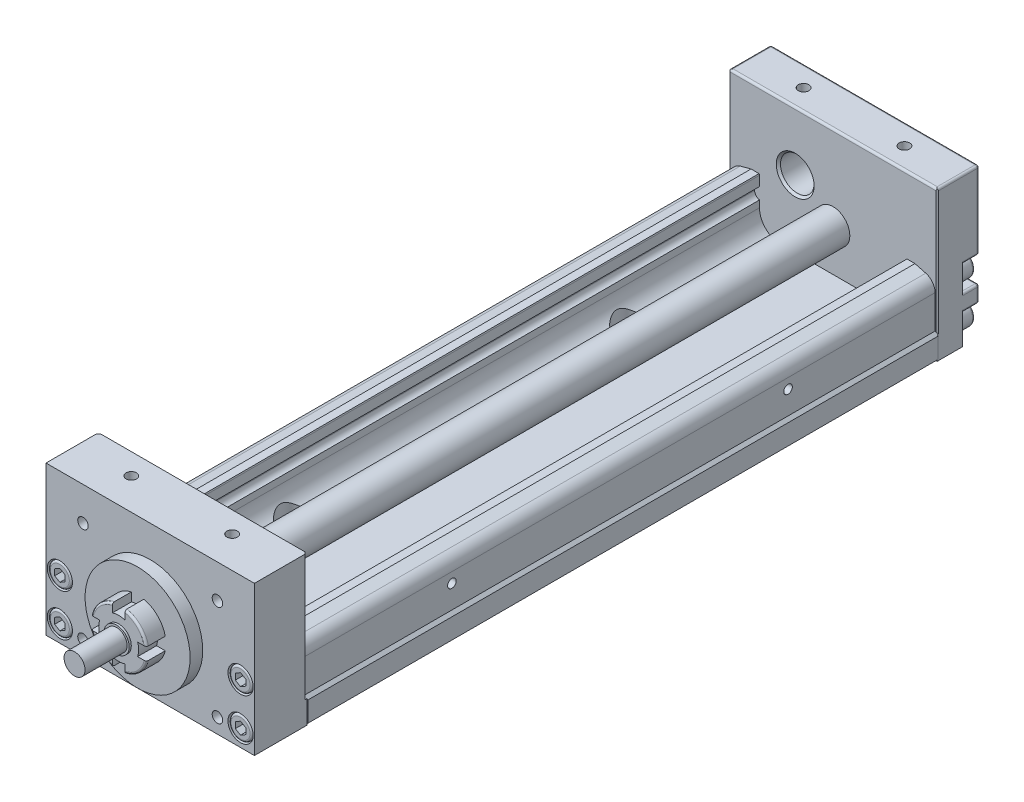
SolidWorks part; units mm, degrees
ref_plane "前视基准面" through (0, 0, 0) normal (0, 0, 1) x (1, 0, 0)
ref_plane "上视基准面" through (0, 0, 0) normal (0, 1, 0) x (1, 0, 0)
ref_plane "右视基准面" through (0, 0, 0) normal (1, 0, 0) x (0, 0, -1)
sketch "Model" plane through (0, 0, 0) normal (0, 0, 1) x (1, 0, 0)
  line L0 (26.1875, 16.7592) -> (26.6875, 16.2592)
  line L1 (23.1875, 16.7592) -> (26.1875, 16.7592)
  line L2 (22.6875, 17.2592) -> (23.1875, 16.7592)
  line L3 (22.6875, 17.2592) -> (22.6875, 22.0592)
  line L4 (23.3875, 22.7592) -> (22.6875, 22.0592)
  line L5 (23.3875, 30.671) -> (23.3875, 22.7592)
  line L6 (28.1875, 34.2592) -> (25.6111, 33.5688)
  line L7 (28.1875, 34.2592) -> (30.0875, 34.2592)
  line L8 (30.1875, 31.6398) -> (30.1875, 33.9592)
  line L9 (30.1875, 27.2592) -> (30.1875, 28.8785)
  line L10 (60.1875, 22.2592) -> (35.1875, 22.2592)
  line L11 (65.1875, 28.8785) -> (65.1875, 27.2592)
  line L12 (65.1875, 33.9592) -> (65.1875, 31.6398)
  line L13 (65.2875, 34.2592) -> (67.1875, 34.2592)
  line L14 (69.764, 33.5688) -> (67.1875, 34.2592)
  line L15 (71.9875, 22.7592) -> (71.9875, 30.671)
  line L16 (72.6875, 22.0592) -> (71.9875, 22.7592)
  line L17 (72.1875, 16.7592) -> (72.6875, 17.2592)
  line L18 (69.1875, 16.7592) -> (72.1875, 16.7592)
  line L19 (68.6875, 16.2592) -> (69.1875, 16.7592)
  line L20 (68.6875, 16.2592) -> (54.6875, 16.2592)
  line L21 (54.1875, 16.7592) -> (54.6875, 16.2592)
  line L22 (41.1875, 16.7592) -> (54.1875, 16.7592)
  line L23 (40.6875, 16.2592) -> (41.1875, 16.7592)
  line L24 (40.6875, 16.2592) -> (26.6875, 16.2592)
  line L25 (72.6875, 22.0592) -> (72.6875, 17.2592)
  arc A0 (25.6111, 33.5688) -> (23.3875, 30.671) centre (26.3875, 30.671) ccw
  arc A1 (30.1875, 33.9592) -> (30.0875, 34.2592) centre (29.6875, 33.9592) ccw
  arc A2 (30.1875, 31.6398) -> (29.0253, 30.2592) centre (30.4965, 30.2002) ccw
  arc A3 (29.0253, 30.2592) -> (30.1875, 28.8785) centre (30.4965, 30.3181) ccw
  arc A4 (30.1875, 27.2592) -> (35.1875, 22.2592) centre (35.1875, 27.2592) ccw
  arc A5 (60.1875, 22.2592) -> (65.1875, 27.2592) centre (60.1875, 27.2592) ccw
  arc A6 (65.1875, 28.8785) -> (66.3498, 30.2592) centre (64.8786, 30.3181) ccw
  arc A7 (66.3498, 30.2592) -> (65.1875, 31.6398) centre (64.8786, 30.2002) ccw
  arc A8 (65.2875, 34.2592) -> (65.1875, 33.9592) centre (65.6875, 33.9592) ccw
  arc A9 (71.9875, 30.671) -> (69.764, 33.5688) centre (68.9875, 30.671) ccw
extrude "凸台-拉伸1" add sketch "Model" along normal mid plane 150
hole_wizard "打孔尺寸(%根据)内六角圆柱头螺钉的类型1" positions "草图2" profile "草图1" counterbore size "M4" standard "GB"
sketch "草图2" plane through (0, 22.2592, 0) normal (0, 1, 0) x (1, 0, 0)
  line L0 (47.6875, -75) -> (47.6875, 75) construction
  line L1 (60.1875, -75) -> (35.1875, -75) construction
  line L2 (60.1875, 75) -> (35.1875, 75) construction
  point P0 (35.1875, -40)
  point P2 (60.1875, -40)
  dimension "D1" = 25
  dimension "D2" = 35
sketch "草图1" plane through (35.1875, 22.2592, 40) normal (1, 0, 0) x (0, 0, 1)
  line L0 (0, 0) -> (0, 6)
  line L1 (0, 6) -> (2.25, 6)
  line L3 (2.25, 6) -> (2.25, 4.6)
  line L4 (2.25, 4.6) -> (4, 4.6)
  line L5 (4, 4.6) -> (4, 0)
  line L7 (4, 0) -> (0, 0)
  line L11 (0, -6.35) -> (0, 107.95) construction
  dimension "通孔孔直径" = 4.5
  dimension "通孔孔深度" = 6
  dimension "柱形沉头孔直径" = 8
  dimension "柱形沉头孔深度" = 4.6
sketch "草图3" plane through (0, 22.2592, 0) normal (0, 1, 0) x (1, 0, 0)
  circle A0 centre (35.1875, -40) radius 4 construction
  circle A1 centre (60.1875, -40) radius 4 construction
  circle A2 centre (35.1875, -40) radius 4
  circle A3 centre (60.1875, -40) radius 4
extrude "切除-拉伸1" cut sketch "草图3" along normal blind 150
pattern_linear "阵列(线性)1" count 2 spacing 80 along (0, 0, -1) of "切除-拉伸1", "打孔尺寸(%根据)内六角圆柱头螺钉的类型1"
hole_wizard "M2.5 螺纹孔1" positions "草图5" profile "草图6" tap size "M2.5" standard "GB"
sketch "草图5" plane through (71.9875, 0, 0) normal (1, 0, 0) x (0, 0, -1)
  line L0 (-75, 22.7592) -> (-75, 30.671) construction
  line L1 (-75, 16.2592) -> (75, 16.2592) construction
  point P0 (-40, 28.2592)
  dimension "D1" = 35
  dimension "D2" = 12
sketch "草图6" plane through (71.9875, 28.2592, 40) normal (0, 1, 0) x (0, 0, -1)
  line L0 (0, 0) -> (0, 5.6159)
  line L1 (0, 5.6159) -> (1.025, 5)
  line L2 (1.025, 5) -> (1.025, 0)
  line L5 (1.025, 0) -> (0, 0)
  line L10 (0, 5.6159) -> (-1.025, 5) construction
  line L11 (0, -6.35) -> (0, 107.95) construction
  dimension "螺纹孔钻头直径" = 2.05
  dimension "螺纹孔钻头深度" = 5
  dimension "导头角度" = 118
hole_wizard "M2.5 螺纹孔2" positions "草图8" profile "草图7" tap size "M2.5" standard "GB"
sketch "草图8" plane through (23.3875, 0, 0) normal (-1, 0, 0) x (0, 0, 1)
  point P0 (40, 28.2592)
sketch "草图7" plane through (23.3875, 28.2592, 40) normal (0, 1, 0) x (0, 0, 1)
  line L0 (0, 0) -> (0, 5.6159)
  line L1 (0, 5.6159) -> (1.025, 5)
  line L2 (1.025, 5) -> (1.025, 0)
  line L5 (1.025, 0) -> (0, 0)
  line L10 (0, 5.6159) -> (-1.025, 5) construction
  line L11 (0, -6.35) -> (0, 107.95) construction
  dimension "螺纹孔钻头直径" = 2.05
  dimension "螺纹孔钻头深度" = 5
  dimension "导头角度" = 118
pattern_linear "阵列(线性)2" count 2 spacing 80 along (0, 0, -1) of "M2.5 螺纹孔2", "M2.5 螺纹孔1"
sketch "草图9" plane through (0, 0, 75) normal (0, 0, 1) x (1, 0, 0)
  line L0 (47.6875, 16.7592) -> (47.6875, 50.1591) construction
  line L1 (22.8875, 54.7592) -> (72.4875, 54.7592)
  line L2 (22.8875, 54.7592) -> (22.8875, 16.7592)
  line L3 (22.8875, 16.7592) -> (72.4875, 16.7592)
  line L4 (72.4875, 54.7592) -> (72.4875, 16.7592)
  line L5 (41.1875, 16.7592) -> (54.1875, 16.7592) construction
  line L6 (26.6875, 16.2592) -> (40.6875, 16.2592) construction
  line L7 (54.6875, 16.2592) -> (68.6875, 16.2592) construction
  circle A0 centre (47.6875, 32.2592) radius 4
  dimension "D4" = 8
  dimension "D5" = 16
  dimension "D1" = 49.6
  dimension "D2" = 0.5
  dimension "D3" = 38.5
extrude "凸台-拉伸2" add sketch "草图9" along normal blind 60
sketch "草图10" plane through (72.4875, 0, 0) normal (1, 0, 0) x (0, 0, -1)
  line L0 (-84, 16.7592) -> (-84, 37.2592)
  line L1 (-135, 16.7592) -> (-75, 16.7592) construction
  line L2 (-84, 37.2592) -> (-92, 37.2592)
  line L3 (-92, 37.2592) -> (-92, 43.2592)
  line L4 (-92, 43.2592) -> (-120, 43.2592)
  line L5 (-120, 43.2592) -> (-120, 16.7592)
  line L6 (-120, 16.7592) -> (-84, 16.7592)
  line L7 (-75, 22.2592) -> (-75, 54.7592) construction
  dimension "D1" = 9
  dimension "D2" = 8
  dimension "D3" = 36
  dimension "D4" = 20.5
  dimension "D5" = 26.5
extrude "切除-拉伸2" cut sketch "草图10" against normal blind 11
sketch "草图11" plane through (22.8875, 0, 0) normal (-1, 0, 0) x (0, 0, 1)
  line L6 (84, 16.7592) -> (120, 16.7592)
  line L7 (84, 37.2592) -> (84, 16.7592)
  line L8 (92, 37.2592) -> (84, 37.2592)
  line L9 (92, 43.2592) -> (92, 37.2592)
  line L10 (120, 43.2592) -> (92, 43.2592)
  line L11 (120, 16.7592) -> (120, 43.2592)
  line L12 (84, 16.7592) -> (120, 16.7592)
  line L13 (84, 37.2592) -> (84, 16.7592)
  line L14 (92, 37.2592) -> (84, 37.2592)
  line L15 (92, 43.2592) -> (92, 37.2592)
  line L16 (120, 43.2592) -> (92, 43.2592)
  line L17 (120, 16.7592) -> (120, 43.2592)
  dimension "D1" = 0
extrude "切除-拉伸3" cut sketch "草图11" against normal blind 11
sketch "草图12" plane through (0, 54.7592, 0) normal (0, 1, 0) x (1, 0, 0)
  line L0 (47.6875, 75) -> (47.6875, -135) construction
  line L1 (60.1875, 75) -> (35.1875, 75) construction
  line L2 (72.4875, -135) -> (22.8875, -135) construction
  line L3 (60.1875, -75) -> (35.1875, -75) construction
  line L4 (32.6875, -90.5) -> (62.6875, -90.5)
  line L5 (32.6875, -90.5) -> (32.6875, -123)
  line L6 (32.6875, -123) -> (62.6875, -123)
  line L7 (62.6875, -90.5) -> (62.6875, -123)
  dimension "D1" = 15.5
  dimension "D2" = 32.5
  dimension "D3" = 30
extrude "切除-拉伸4" cut sketch "草图12" against normal blind 33
sketch "草图13" plane through (0, 0, 135) normal (0, 0, 1) x (1, 0, 0)
  circle A0 centre (47.6875, 32.2592) radius 12
  dimension "D1" = 24
extrude "切除-拉伸5" cut sketch "草图13" against normal up to surface (44.5 mm away)
sketch "草图15" plane through (22.8875, 0, 0) normal (-1, 0, 0) x (0, 0, 1)
  line L1 (75, 54.7592) -> (90, 54.7592)
  line L2 (75, 54.7592) -> (75, 52.2592)
  line L3 (75, 52.2592) -> (90, 52.2592)
  line L4 (90, 54.7592) -> (90, 52.2592)
  dimension "D1" = 2.5
  dimension "D2" = 15
extrude "切除-拉伸6" cut sketch "草图15" against normal through all
hole_wizard "M3 螺纹孔1" positions "草图18" profile "草图17" tap size "M3" standard "GB"
sketch "草图18" plane through (0, 0, 135) normal (0, 0, 1) x (1, 0, 0)
  line L0 (47.6875, 44.2592) -> (47.6875, 32.2592) construction
  line L1 (47.6875, 32.2592) -> (35.6875, 32.2592) construction
  line L3 (36.0203, 43.9264) -> (59.3548, 20.5919) construction
  line L5 (59.3548, 43.9264) -> (36.0203, 20.5919) construction
  circle A0 centre (47.6875, 32.2592) radius 12 construction
  circle A1 centre (47.6875, 32.2592) radius 16.5
  point P0 (36.0203, 43.9264)
  point P16 (59.3548, 20.5919)
  point P18 (59.3548, 43.9264)
  point P19 (36.0203, 20.5919)
  dimension "D1" = 33
  dimension "D2" = 45
sketch "草图17" plane through (36.0203, 43.9264, 135) normal (1, 0, 0) x (0, -1, 0)
  line L0 (0, 0) -> (0, 9.2511)
  line L1 (0, 9.2511) -> (1.25, 8.5)
  line L2 (1.25, 8.5) -> (1.25, 0)
  line L5 (1.25, 0) -> (0, 0)
  line L10 (0, 9.2511) -> (-1.25, 8.5) construction
  line L11 (0, -6.35) -> (0, 107.95) construction
  dimension "螺纹孔钻头直径" = 2.5
  dimension "螺纹孔钻头深度" = 8.5
  dimension "导头角度" = 118
sketch "草图19" plane through (0, 0, 135) normal (0, 0, 1) x (1, 0, 0)
  line L0 (47.6875, 54.7592) -> (47.6875, 16.7592) construction
  line L1 (72.4875, 54.7592) -> (22.8875, 54.7592) construction
  line L2 (22.8875, 16.7592) -> (72.4875, 16.7592) construction
  circle A0 centre (26.1875, 30.7592) radius 1.75
  circle A1 centre (26.1875, 20.7592) radius 1.75
  circle A2 centre (69.1875, 30.7592) radius 1.75
  circle A3 centre (69.1875, 20.7592) radius 1.75
  dimension "D1" = 43
  dimension "D2" = 4
  dimension "D3" = 10
  dimension "D4" = 3.5
extrude "切除-拉伸7" cut sketch "草图19" against normal blind 33
fillet "圆角1" radius 2.5 8 edges at (27.7875, 43.2592, 120) (67.5875, 43.2592, 120) (66.9875, 37.2592, 84) (67.5875, 37.2592, 92) (67.5875, 43.2592, 92) (28.3875, 37.2592, 84) (27.7875, 37.2592, 92) (27.7875, 43.2592, 92)
fillet "圆角2" radius 1.5 4 edges at (32.6875, 38.2592, 123) (32.6875, 46.1135, 90.5) (62.6875, 38.2592, 123) (62.6875, 46.1135, 90.5)
fillet "圆角3" radius 0.5 28 edges at (72.4875, 25.7592, 84) (72.4875, 36.5269, 84.7322) (72.4875, 37.2592, 88) (72.4875, 37.9914, 91.2678) (72.4875, 40.2592, 92) (72.4875, 42.5269, 92.7322) (72.4875, 28.7592, 120) (72.4875, 42.5269, 119.2678) (22.8875, 25.7592, 84) (22.8875, 42.5269, 119.2678) (22.8875, 43.2592, 106) (22.8875, 42.5269, 92.7322) (22.8875, 40.2592, 92) (22.8875, 37.9914, 91.2678) (22.8875, 37.2592, 88) (62.2482, 54.7592, 90.9393) (62.6875, 54.7592, 106.75) (62.2482, 54.7592, 122.5607) (33.1269, 54.7592, 122.5607) (32.6875, 54.7592, 106.75) (33.1269, 54.7592, 90.9393) (72.4875, 43.2592, 106) (22.8875, 36.5269, 84.7322) (47.6875, 54.7592, 90.5) (72.4875, 54.7592, 112.5) (22.8875, 54.7592, 112.5) (22.8875, 28.7592, 120) (47.6875, 54.7592, 123)
chamfer "倒角1" distance 0.5 angle 45 17 edges at (47.6875, 16.7592, 135) (22.8875, 35.5092, 135) (23.034, 54.6127, 135) (47.6875, 54.7592, 135) (72.3411, 54.6127, 135) (72.4875, 35.5092, 135) (59.6875, 32.2592, 135) (37.2703, 20.5919, 135) (60.6048, 43.9264, 135) (60.6048, 20.5919, 135) (37.2703, 43.9264, 135) (27.9375, 30.7592, 135) (27.9375, 20.7592, 135) (70.9375, 30.7592, 135) (70.9375, 20.7592, 135) (22.8875, 37.2592, 75) (72.4875, 37.2592, 75)
sketch "草图20" plane through (0, 0, 90.5) normal (0, 0, 1) x (1, 0, 0)
  circle A0 centre (47.6875, 32.2592) radius 4 construction
  circle A1 centre (47.6875, 32.2592) radius 4
extrude "凸台-拉伸3" add sketch "草图20" against normal up to surface (165.5 mm away)
sketch "草图21" plane through (0, 0, 90.5) normal (0, 0, 1) x (1, 0, 0)
  line L0 (47.6875, 39.0092) -> (47.6875, 25.5092) construction
  line L1 (42.9375, 32.2592) -> (52.4375, 32.2592) construction
  line L2 (46.1875, 38.8404) -> (46.1875, 36.7661)
  line L3 (41.1063, 30.7592) -> (43.1806, 30.7592)
  line L4 (49.1875, 38.8404) -> (49.1875, 36.7661)
  line L5 (41.1063, 33.7592) -> (43.1806, 33.7592)
  line L6 (46.1875, 33.7592) -> (46.1875, 30.7592) construction
  line L7 (46.1875, 39.0092) -> (46.1875, 25.5092) construction
  line L8 (49.1875, 39.0092) -> (49.1875, 25.5092) construction
  line L9 (49.1875, 33.7592) -> (49.1875, 30.7592) construction
  line L10 (42.9375, 33.7592) -> (52.4375, 33.7592) construction
  line L11 (42.9375, 30.7592) -> (52.4375, 30.7592) construction
  line L12 (52.1945, 30.7592) -> (54.2688, 30.7592)
  line L13 (52.1945, 33.7592) -> (54.2688, 33.7592)
  line L14 (46.1875, 33.7592) -> (49.1875, 33.7592) construction
  line L15 (46.1875, 30.7592) -> (49.1875, 30.7592) construction
  line L16 (46.1875, 27.7522) -> (46.1875, 25.6779)
  line L17 (49.1875, 27.7522) -> (49.1875, 25.6779)
  arc A0 (46.1875, 38.8404) -> (41.1063, 33.7592) centre (47.6875, 32.2592) ccw
  arc A1 (49.1875, 36.7661) -> (46.1875, 36.7661) centre (47.6875, 32.2592) ccw
  arc A2 (43.1806, 33.7592) -> (43.1806, 30.7592) centre (47.6875, 32.2592) ccw
  arc A3 (41.1063, 30.7592) -> (46.1875, 25.6779) centre (47.6875, 32.2592) ccw
  arc A4 (49.1875, 25.6779) -> (54.2688, 30.7592) centre (47.6875, 32.2592) ccw
  arc A5 (54.2688, 33.7592) -> (49.1875, 38.8404) centre (47.6875, 32.2592) ccw
  arc A6 (46.1875, 27.7522) -> (49.1875, 27.7522) centre (47.6875, 32.2592) ccw
  arc A7 (52.1945, 30.7592) -> (52.1945, 33.7592) centre (47.6875, 32.2592) ccw
  dimension "D1" = 13.5
  dimension "D3" = 9.5
  dimension "D4" = 1.5
  dimension "D5" = 1.5
extrude "凸台-拉伸4" add sketch "草图21" along normal blind 4.5
sketch "草图22" plane through (0, 0, 95) normal (0, 0, 1) x (1, 0, 0)
  circle A0 centre (47.6875, 32.2592) radius 3
  dimension "D1" = 6
extrude "凸台-拉伸5" add sketch "草图22" along normal blind 0.5
sketch "草图23" plane through (0, 0, 95.5) normal (0, 0, 1) x (1, 0, 0)
  circle A0 centre (47.6875, 32.2592) radius 2.5
  dimension "D1" = 5
extrude "凸台-拉伸6" add sketch "草图23" along normal blind 10
fillet "圆角4" radius 0.5 4 edges at (52.4605, 27.4862, 95) (42.9146, 27.4862, 95) (42.9146, 37.0321, 95) (52.4605, 37.0321, 95)
sketch "草图24" plane through (0, 0, 84) normal (0, 0, 1) x (1, 0, 0)
  circle A0 centre (26.1875, 30.7592) radius 2.75
  circle A1 centre (26.1875, 20.7592) radius 2.75
  circle A2 centre (69.1875, 30.7592) radius 2.75
  circle A3 centre (69.1875, 20.7592) radius 2.75
  dimension "D1" = 5.5
extrude "凸台-拉伸7" add sketch "草图24" along normal blind 3.5
sketch "草图25" plane through (0, 0, 87.5) normal (0, 0, 1) x (1, 0, 0)
  line L1 (26.1875, 32.2025) -> (24.9375, 31.4808)
  line L2 (24.9375, 31.4808) -> (24.9375, 30.0375)
  line L3 (24.9375, 30.0375) -> (26.1875, 29.3158)
  line L4 (26.1875, 29.3158) -> (27.4375, 30.0375)
  line L5 (27.4375, 30.0375) -> (27.4375, 31.4808)
  line L6 (27.4375, 31.4808) -> (26.1875, 32.2025)
  line L7 (26.1875, 22.2025) -> (24.9375, 21.4808)
  line L8 (24.9375, 21.4808) -> (24.9375, 20.0375)
  line L9 (24.9375, 20.0375) -> (26.1875, 19.3158)
  line L10 (26.1875, 19.3158) -> (27.4375, 20.0375)
  line L11 (27.4375, 20.0375) -> (27.4375, 21.4808)
  line L12 (27.4375, 21.4808) -> (26.1875, 22.2025)
  line L13 (69.1875, 22.2025) -> (67.9375, 21.4808)
  line L14 (67.9375, 21.4808) -> (67.9375, 20.0375)
  line L15 (67.9375, 20.0375) -> (69.1875, 19.3158)
  line L16 (69.1875, 19.3158) -> (70.4375, 20.0375)
  line L17 (70.4375, 20.0375) -> (70.4375, 21.4808)
  line L18 (70.4375, 21.4808) -> (69.1875, 22.2025)
  line L19 (69.1875, 32.2025) -> (67.9375, 31.4808)
  line L20 (67.9375, 31.4808) -> (67.9375, 30.0375)
  line L21 (67.9375, 30.0375) -> (69.1875, 29.3158)
  line L22 (69.1875, 29.3158) -> (70.4375, 30.0375)
  line L23 (70.4375, 30.0375) -> (70.4375, 31.4808)
  line L24 (70.4375, 31.4808) -> (69.1875, 32.2025)
  circle A0 centre (26.1875, 30.7592) radius 1.25 construction
  circle A1 centre (26.1875, 20.7592) radius 1.25 construction
  circle A2 centre (69.1875, 20.7592) radius 1.25 construction
  circle A3 centre (69.1875, 30.7592) radius 1.25 construction
  dimension "D1" = 2.5
extrude "切除-拉伸8" cut sketch "草图25" against normal blind 2.5
fillet "圆角5" radius 0.5 4 edges at (71.9375, 30.7592, 87.5) (71.9375, 20.7592, 87.5) (28.9375, 20.7592, 87.5) (28.9375, 30.7592, 87.5)
sketch "草图26" plane through (0, 0, 75) normal (0, 0, -1) x (-1, 0, 0)
  line L0 (-61.1875, 32.2592) -> (-34.1875, 32.2592) construction
  line L13 (-57.7499, 23.2592) -> (-37.6252, 23.2592)
  line L14 (-57.7499, 41.2592) -> (-37.6252, 41.2592)
  line L16 (-61.1875, 41.2592) -> (-34.1875, 41.2592) construction
  line L17 (-61.1875, 23.2592) -> (-34.1875, 23.2592) construction
  arc A0 (-57.7499, 41.2592) -> (-57.7499, 23.2592) centre (-47.6875, 32.2592) ccw
  arc A11 (-37.6252, 23.2592) -> (-37.6252, 41.2592) centre (-47.6875, 32.2592) ccw
  circle A12 centre (-47.6875, 32.2592) radius 6
  dimension "D1" = 27
  dimension "D4" = 12
  dimension "D2" = 9
  dimension "D3" = 9
extrude "凸台-拉伸8" add sketch "草图26" along normal blind 2.5
chamfer "倒角2" distance 0.5 angle 45 5 edges at (41.6875, 32.2592, 72.5) (47.6875, 23.2592, 72.5) (61.1875, 32.2592, 72.5) (47.6875, 41.2592, 72.5) (34.1875, 32.2592, 72.5)
sketch "草图27" plane through (0, 0, 72.5) normal (0, 0, -1) x (-1, 0, 0)
  line L0 (-47.6875, 43.2592) -> (-47.6875, 32.2592) construction
  line L1 (-47.6875, 32.2592) -> (-58.6875, 32.2592) construction
  line L2 (-57.2138, 37.7592) -> (-38.1613, 26.7592) construction
  line L3 (-38.1613, 37.7592) -> (-57.2138, 26.7592) construction
  circle A0 centre (-47.6875, 32.2592) radius 11 construction
  circle A1 centre (-57.2138, 37.7592) radius 2.75
  circle A2 centre (-57.2138, 26.7592) radius 2.75
  circle A3 centre (-38.1613, 37.7592) radius 2.75
  circle A4 centre (-38.1613, 26.7592) radius 2.75
  dimension "D1" = 22
  dimension "D4" = 5.5
  dimension "D2" = 30
  dimension "D3" = 30
extrude "凸台-拉伸9" add sketch "草图27" along normal blind 3.5
sketch "草图28" plane through (0, 0, 69) normal (0, 0, -1) x (-1, 0, 0)
  line L1 (-57.9355, 39.0092) -> (-58.6572, 37.7592)
  line L2 (-58.6572, 37.7592) -> (-57.9355, 36.5092)
  line L3 (-57.9355, 36.5092) -> (-56.4921, 36.5092)
  line L4 (-56.4921, 36.5092) -> (-55.7704, 37.7592)
  line L5 (-55.7704, 37.7592) -> (-56.4921, 39.0092)
  line L6 (-56.4921, 39.0092) -> (-57.9355, 39.0092)
  line L7 (-38.883, 39.0092) -> (-39.6046, 37.7592)
  line L8 (-39.6046, 37.7592) -> (-38.883, 36.5092)
  line L9 (-38.883, 36.5092) -> (-37.4396, 36.5092)
  line L10 (-37.4396, 36.5092) -> (-36.7179, 37.7592)
  line L11 (-36.7179, 37.7592) -> (-37.4396, 39.0092)
  line L12 (-37.4396, 39.0092) -> (-38.883, 39.0092)
  line L13 (-38.883, 28.0092) -> (-39.6046, 26.7592)
  line L14 (-39.6046, 26.7592) -> (-38.883, 25.5092)
  line L15 (-38.883, 25.5092) -> (-37.4396, 25.5092)
  line L16 (-37.4396, 25.5092) -> (-36.7179, 26.7592)
  line L17 (-36.7179, 26.7592) -> (-37.4396, 28.0092)
  line L18 (-37.4396, 28.0092) -> (-38.883, 28.0092)
  line L19 (-57.9355, 28.0092) -> (-58.6572, 26.7592)
  line L20 (-58.6572, 26.7592) -> (-57.9355, 25.5092)
  line L21 (-57.9355, 25.5092) -> (-56.4921, 25.5092)
  line L22 (-56.4921, 25.5092) -> (-55.7704, 26.7592)
  line L23 (-55.7704, 26.7592) -> (-56.4921, 28.0092)
  line L24 (-56.4921, 28.0092) -> (-57.9355, 28.0092)
  circle A0 centre (-57.2138, 37.7592) radius 1.25 construction
  circle A1 centre (-38.1613, 37.7592) radius 1.25 construction
  circle A2 centre (-38.1613, 26.7592) radius 1.25 construction
  circle A3 centre (-57.2138, 26.7592) radius 1.25 construction
  dimension "D1" = 2.5
extrude "切除-拉伸9" cut sketch "草图28" against normal blind 2.5
fillet "圆角6" radius 0.5 4 edges at (35.4113, 26.7592, 69) (54.4638, 26.7592, 69) (54.4638, 37.7592, 69) (35.4113, 37.7592, 69)
sketch "草图29" plane through (0, 0, -75) normal (0, 0, -1) x (-1, 0, 0)
  line L0 (-69.1875, 16.7592) -> (-72.1875, 16.7592) construction
  line L1 (-72.4875, 52.2592) -> (-22.8875, 52.2592)
  line L2 (-72.4875, 52.2592) -> (-72.4875, 16.7592)
  line L3 (-72.4875, 16.7592) -> (-22.8875, 16.7592)
  line L4 (-22.8875, 52.2592) -> (-22.8875, 16.7592)
  line L5 (-22.8875, 52.2592) -> (-22.8875, 22.2592) construction
  line L6 (-72.4875, 22.2592) -> (-72.4875, 52.2592) construction
  line L8 (-72.4875, 52.2592) -> (-22.8875, 52.2592) construction
extrude "凸台-拉伸10" add sketch "草图29" along normal blind 10
sketch "草图30" plane through (0, 0, -85) normal (0, 0, -1) x (-1, 0, 0)
  circle A0 centre (-47.6875, 32.2592) radius 5.5
  dimension "D1" = 11
extrude "切除-拉伸10" cut sketch "草图30" against normal blind 2.5
sketch "草图31" plane through (0, 0, -82.5) normal (0, 0, -1) x (-1, 0, 0)
  circle A0 centre (-47.6875, 32.2592) radius 2.5
  dimension "D1" = 5
extrude "凸台-拉伸11" add sketch "草图31" along normal blind 2 separate body
sketch "草图32" plane through (0, 0, -82.5) normal (0, 0, -1) x (-1, 0, 0)
  circle A0 centre (-47.6875, 32.2592) radius 3
  circle A1 centre (-47.6875, 32.2592) radius 4.5
  dimension "D1" = 9
  dimension "D2" = 6
extrude "切除-拉伸11" cut sketch "草图32" against normal blind 0.3
chamfer "倒角3" distance 0.3 angle 45 1 edges at (45.1875, 32.2592, -84.5)
chamfer "倒角4" distance 0.3 angle 45 3 edges at (42.1875, 32.2592, -85) (22.8875, 37.2592, -75) (72.4875, 37.2592, -75)
fillet "圆角7" radius 0.3 2 edges at (43.1875, 32.2592, -82.5) (44.6875, 32.2592, -82.5)
fillet "圆角8" radius 0.5 7 edges at (47.6875, 16.7592, -85) (22.8875, 34.5092, -85) (72.4875, 34.5092, -85) (47.6875, 52.2592, -85) (47.6875, 52.2592, -75) (22.8875, 52.2592, -80.15) (72.4875, 52.2592, -80.15)
sketch "草图34" plane through (0, 0, -85) normal (0, 0, -1) x (-1, 0, 0)
  line L0 (-69.1875, 33.7592) -> (-72.4875, 33.7592)
  line L1 (-72.4875, 16.7592) -> (-72.4875, 51.7592) construction
  line L2 (-72.4875, 33.7592) -> (-72.4875, 27.7592)
  line L3 (-72.4875, 27.7592) -> (-69.1875, 27.7592)
  line L4 (-69.1875, 23.7592) -> (-72.4875, 23.7592)
  line L5 (-72.4875, 23.7592) -> (-72.4875, 16.7592)
  line L6 (-72.4875, 16.7592) -> (-66.1875, 16.7592)
  line L7 (-69.1875, 16.7592) -> (-54.1875, 16.7592) construction
  line L8 (-66.1875, 16.7592) -> (-66.1875, 20.7592)
  line L9 (-26.1875, 33.7592) -> (-22.8875, 33.7592)
  line L10 (-22.8875, 51.7592) -> (-22.8875, 16.7592) construction
  line L11 (-22.8875, 33.7592) -> (-22.8875, 27.7592)
  line L12 (-22.8875, 27.7592) -> (-26.1875, 27.7592)
  line L13 (-26.1875, 23.7592) -> (-22.8875, 23.7592)
  line L14 (-22.8875, 23.7592) -> (-22.8875, 16.7592)
  line L15 (-22.8875, 16.7592) -> (-29.1875, 16.7592)
  line L16 (-22.8875, 16.7592) -> (-72.4875, 16.7592) construction
  line L17 (-29.1875, 16.7592) -> (-29.1875, 20.7592)
  arc A0 (-69.1875, 27.7592) -> (-69.1875, 33.7592) centre (-69.1875, 30.7592) ccw
  arc A1 (-66.1875, 20.7592) -> (-69.1875, 23.7592) centre (-69.1875, 20.7592) ccw
  arc A2 (-26.1875, 33.7592) -> (-26.1875, 27.7592) centre (-26.1875, 30.7592) ccw
  arc A3 (-26.1875, 23.7592) -> (-29.1875, 20.7592) centre (-26.1875, 20.7592) ccw
  dimension "D1" = 6
extrude "切除-拉伸12" cut sketch "草图34" against normal blind 4
sketch "草图35" plane through (0, 0, -81) normal (0, 0, -1) x (-1, 0, 0)
  circle A0 centre (-69.1875, 30.7592) radius 2.75 construction
  circle A1 centre (-69.1875, 20.7592) radius 2.75 construction
  circle A2 centre (-26.1875, 30.7592) radius 2.75 construction
  circle A3 centre (-26.1875, 20.7592) radius 2.75 construction
  circle A4 centre (-69.1875, 30.7592) radius 2.75
  circle A5 centre (-69.1875, 20.7592) radius 2.75
  circle A6 centre (-26.1875, 30.7592) radius 2.75
  circle A7 centre (-26.1875, 20.7592) radius 2.75
extrude "凸台-拉伸12" add sketch "草图35" along normal blind 3.5
sketch "草图36" plane through (0, 0, -84.5) normal (0, 0, -1) x (-1, 0, 0)
  line L0 (-70.4375, 31.4808) -> (-69.1875, 32.2025) construction
  line L1 (-69.1875, 32.2025) -> (-67.9375, 31.4808) construction
  line L2 (-67.9375, 31.4808) -> (-67.9375, 30.0375) construction
  line L3 (-67.9375, 30.0375) -> (-69.1875, 29.3158) construction
  line L4 (-69.1875, 29.3158) -> (-70.4375, 30.0375) construction
  line L5 (-70.4375, 30.0375) -> (-70.4375, 31.4808) construction
  line L6 (-70.4375, 21.4808) -> (-69.1875, 22.2025) construction
  line L7 (-69.1875, 22.2025) -> (-67.9375, 21.4808) construction
  line L8 (-67.9375, 21.4808) -> (-67.9375, 20.0375) construction
  line L9 (-67.9375, 20.0375) -> (-69.1875, 19.3158) construction
  line L10 (-69.1875, 19.3158) -> (-70.4375, 20.0375) construction
  line L11 (-70.4375, 20.0375) -> (-70.4375, 21.4808) construction
  line L12 (-27.4375, 21.4808) -> (-26.1875, 22.2025) construction
  line L13 (-26.1875, 22.2025) -> (-24.9375, 21.4808) construction
  line L14 (-24.9375, 21.4808) -> (-24.9375, 20.0375) construction
  line L15 (-24.9375, 20.0375) -> (-26.1875, 19.3158) construction
  line L16 (-26.1875, 19.3158) -> (-27.4375, 20.0375) construction
  line L17 (-27.4375, 20.0375) -> (-27.4375, 21.4808) construction
  line L18 (-27.4375, 31.4808) -> (-26.1875, 32.2025) construction
  line L19 (-26.1875, 32.2025) -> (-24.9375, 31.4808) construction
  line L20 (-24.9375, 31.4808) -> (-24.9375, 30.0375) construction
  line L21 (-24.9375, 30.0375) -> (-26.1875, 29.3158) construction
  line L22 (-26.1875, 29.3158) -> (-27.4375, 30.0375) construction
  line L23 (-27.4375, 30.0375) -> (-27.4375, 31.4808) construction
  line L24 (-70.4375, 31.4808) -> (-69.1875, 32.2025)
  line L25 (-69.1875, 32.2025) -> (-67.9375, 31.4808)
  line L26 (-67.9375, 31.4808) -> (-67.9375, 30.0375)
  line L27 (-67.9375, 30.0375) -> (-69.1875, 29.3158)
  line L28 (-69.1875, 29.3158) -> (-70.4375, 30.0375)
  line L29 (-70.4375, 30.0375) -> (-70.4375, 31.4808)
  line L30 (-70.4375, 21.4808) -> (-69.1875, 22.2025)
  line L31 (-69.1875, 22.2025) -> (-67.9375, 21.4808)
  line L32 (-67.9375, 21.4808) -> (-67.9375, 20.0375)
  line L33 (-67.9375, 20.0375) -> (-69.1875, 19.3158)
  line L34 (-69.1875, 19.3158) -> (-70.4375, 20.0375)
  line L35 (-70.4375, 20.0375) -> (-70.4375, 21.4808)
  line L36 (-27.4375, 21.4808) -> (-26.1875, 22.2025)
  line L37 (-26.1875, 22.2025) -> (-24.9375, 21.4808)
  line L38 (-24.9375, 21.4808) -> (-24.9375, 20.0375)
  line L39 (-24.9375, 20.0375) -> (-26.1875, 19.3158)
  line L40 (-26.1875, 19.3158) -> (-27.4375, 20.0375)
  line L41 (-27.4375, 20.0375) -> (-27.4375, 21.4808)
  line L42 (-27.4375, 31.4808) -> (-26.1875, 32.2025)
  line L43 (-26.1875, 32.2025) -> (-24.9375, 31.4808)
  line L44 (-24.9375, 31.4808) -> (-24.9375, 30.0375)
  line L45 (-24.9375, 30.0375) -> (-26.1875, 29.3158)
  line L46 (-26.1875, 29.3158) -> (-27.4375, 30.0375)
  line L47 (-27.4375, 30.0375) -> (-27.4375, 31.4808)
extrude "切除-拉伸13" cut sketch "草图36" against normal blind 2.5
fillet "圆角9" radius 0.5 32 edges at (66.1875, 16.7592, -82.75) (66.1875, 16.9056, -84.8536) (66.1875, 19.0092, -85) (72.4875, 23.7592, -82.75) (72.3411, 23.7592, -84.8536) (70.5875, 23.7592, -85) (22.8875, 23.7592, -82.75) (23.034, 23.7592, -84.8536) (24.7875, 23.7592, -85) (29.1875, 16.7592, -82.75) (29.1875, 16.9056, -84.8536) (29.1875, 19.0092, -85) (22.8875, 33.7592, -82.75) (23.034, 33.7592, -84.8536) (22.8875, 27.7592, -82.75) (23.034, 27.7592, -84.8536) (24.7875, 27.7592, -85) (29.1875, 30.7592, -85) (72.4875, 27.7592, -82.75) (72.3411, 27.7592, -84.8536) (70.5875, 27.7592, -85) (66.1875, 30.7592, -85) (72.4875, 33.7592, -82.75) (72.3411, 33.7592, -84.8536) (67.0662, 22.8805, -85) (23.4375, 20.7592, -84.5) (28.3089, 22.8805, -85) (24.7875, 33.7592, -85) (23.4375, 30.7592, -84.5) (70.5875, 33.7592, -85) (66.4375, 30.7592, -84.5) (66.4375, 20.7592, -84.5)
hole_wizard "M3 螺纹孔2" positions "草图40" profile "草图39" tap size "M3" standard "GB"
sketch "草图40" plane through (0, 52.2592, 0) normal (0, 1, 0) x (1, 0, 0)
  line L0 (47.6875, 85) -> (47.6875, -134.5) construction
  line L1 (23.3875, 85) -> (71.9875, 85) construction
  line L2 (23.3875, -134.5) -> (71.9875, -134.5) construction
  line L4 (71.9875, -75) -> (23.3875, -75) construction
  point P0 (59.6875, 80)
  point P2 (35.6875, 80)
  point P4 (59.6875, -80)
  point P6 (35.6875, -80)
  dimension "D1" = 5
  dimension "D2" = 24
  dimension "D3" = 5
sketch "草图39" plane through (59.6875, 52.2592, -80) normal (1, 0, 0) x (0, 0, 1)
  line L0 (0, 0) -> (0, 9.2511)
  line L1 (0, 9.2511) -> (1.25, 8.5)
  line L2 (1.25, 8.5) -> (1.25, 0)
  line L5 (1.25, 0) -> (0, 0)
  line L10 (0, 9.2511) -> (-1.25, 8.5) construction
  line L11 (0, -6.35) -> (0, 107.95) construction
  dimension "螺纹孔钻头直径" = 2.5
  dimension "螺纹孔钻头深度" = 8.5
  dimension "导头角度" = 118
sketch "草图41" plane through (0, 16.7592, 0) normal (0, -1, 0) x (1, 0, 0)
  line L0 (23.3875, 135) -> (71.9875, 135) construction
  line L1 (38.6875, 115) -> (56.6875, 115)
  line L2 (36.6875, 113) -> (36.6875, 101)
  line L3 (38.6875, 99) -> (56.6875, 99)
  line L4 (58.6875, 113) -> (58.6875, 101)
  line L5 (47.6875, 135) -> (47.6875, 91.4107) construction
  arc A0 (36.6875, 101) -> (38.6875, 99) centre (38.6875, 101) ccw
  arc A1 (56.6875, 99) -> (58.6875, 101) centre (56.6875, 101) ccw
  arc A2 (58.6875, 113) -> (56.6875, 115) centre (56.6875, 113) ccw
  arc A3 (36.6875, 113) -> (38.6875, 115) centre (38.6875, 113) cw
  point P12 (58.6875, 99)
  point P15 (58.6875, 115)
  point P18 (36.6875, 115)
  dimension "D4" = 2
  dimension "D1" = 20
  dimension "D2" = 16
  dimension "D3" = 22
extrude "切除-拉伸14" cut sketch "草图41" against normal blind 0.2
sketch "草图42" plane through (0, 16.9592, 0) normal (0, -1, 0) x (1, 0, 0)
  line L0 (36.6875, 113) -> (36.6875, 101) construction
  line L1 (38.6875, 99) -> (56.6875, 99) construction
  text T0 "KKR50" font "仿宋" height 5
  dimension "D1" = 2
  dimension "D2" = 5.5
extrude "凸台-拉伸13" add sketch "草图42" along normal blind 0.2
sketch "草图43" plane through (0, 0, -75) normal (0, 0, 1) x (1, 0, 0)
  circle A0 centre (38.6875, 38.2592) radius 4
  circle A1 centre (47.6875, 32.2592) radius 4 construction
  dimension "D1" = 9
  dimension "D2" = 6
  dimension "D3" = 8
extrude "切除-拉伸15" cut sketch "草图43" against normal blind 8
chamfer "倒角5" distance 0.5 angle 45 1 edges at (42.6875, 38.2592, -75)
sketch "草图44" plane through (0, 0, 135) normal (0, 0, 1) x (1, 0, 0)
  line L1 (15.8105, 57.969) -> (81.195, 57.969)
  line L2 (15.8105, 57.969) -> (15.8105, 10.183)
  line L3 (15.8105, 10.183) -> (81.195, 10.183)
  line L4 (81.195, 57.969) -> (81.195, 10.183)
  circle A0 centre (47.6875, 32.2592) radius 12 construction
  circle A1 centre (47.6875, 32.2592) radius 12
extrude "切除-拉伸16" cut sketch "草图44" against normal up to surface (44.5 mm away)
sketch "草图45" plane through (0, 0, 90.5) normal (0, 0, 1) x (1, 0, 0)
  line L0 (22.8875, 38.0271) -> (22.8875, 54.2592) construction
  line L1 (22.8875, 41.0081) -> (34.9187, 41.0081)
  line L2 (22.8875, 41.0081) -> (22.8875, 16.7592)
  line L3 (22.8875, 16.7592) -> (34.9187, 16.7592)
  line L4 (34.9187, 41.0081) -> (34.9187, 16.7592)
  line L5 (61.4875, 16.7592) -> (33.8875, 16.7592) construction
  line L6 (69.1875, 16.7592) -> (54.1875, 16.7592) construction
  line L7 (58.9955, 16.7592) -> (72.4875, 16.7592)
  line L8 (58.9955, 16.7592) -> (58.9955, 40.0342)
  line L9 (58.9955, 40.0342) -> (72.4875, 40.0342)
  line L10 (72.4875, 16.7592) -> (72.4875, 40.0342)
  line L11 (72.4875, 54.2592) -> (72.4875, 38.0271) construction
  circle A0 centre (26.1875, 30.7592) radius 3
  circle A1 centre (26.1875, 20.7592) radius 3
  circle A2 centre (69.1875, 20.7592) radius 3
  circle A3 centre (69.1875, 30.7592) radius 3
  dimension "D1" = 6
extrude "凸台-拉伸14" add sketch "草图45" against normal blind 10
sketch "草图46" plane through (0, 0, 90.5) normal (0, 0, 1) x (1, 0, 0)
  line L1 (14.3414, 59.2047) -> (80.2545, 59.2047)
  line L2 (14.3414, 59.2047) -> (14.3414, 8.796)
  line L3 (14.3414, 8.796) -> (80.2545, 8.796)
  line L4 (80.2545, 59.2047) -> (80.2545, 8.796)
  circle A0 centre (47.6875, 32.2592) radius 12.5
  circle A1 centre (26.1875, 20.7592) radius 3 construction
  circle A2 centre (26.1875, 30.7592) radius 3 construction
  circle A3 centre (69.1875, 30.7592) radius 3 construction
  circle A4 centre (69.1875, 20.7592) radius 3 construction
  circle A5 centre (26.1875, 20.7592) radius 3
  circle A6 centre (26.1875, 30.7592) radius 3
  circle A7 centre (69.1875, 30.7592) radius 3
  circle A8 centre (69.1875, 20.7592) radius 3
  dimension "D1" = 25
extrude "切除-拉伸18" cut sketch "草图46" against normal blind 3
hole_wizard "M3 螺纹孔的螺纹孔钻头1" positions "草图48" profile "草图49" hole size "M3" standard "GB"
sketch "草图48" plane through (0, 0, 87.5) normal (0, 0, 1) x (1, 0, 0)
  line L0 (47.6875, 16.7592) -> (47.6875, 32.2592) construction
  line L1 (22.8875, 16.7592) -> (72.4875, 16.7592) construction
  line L2 (47.6875, 32.2592) -> (64.9372, 32.2592) construction
  point P0 (31.6875, 44.2592)
  point P2 (63.6875, 44.2592)
  point P4 (63.6875, 20.2592)
  point P6 (31.6875, 20.2592)
  dimension "D1" = 24
  dimension "D2" = 32
sketch "草图49" plane through (31.6875, 44.2592, 87.5) normal (1, 0, 0) x (0, -1, 0)
  line L0 (0, 0) -> (0, 9.2511)
  line L1 (0, 9.2511) -> (1.25, 8.5)
  line L2 (1.25, 8.5) -> (1.25, 0)
  line L5 (1.25, 0) -> (0, 0)
  line L10 (0, 9.2511) -> (-1.25, 8.5) construction
  line L11 (0, -6.35) -> (0, 107.95) construction
  dimension "孔直径" = 2.5
  dimension "孔深度" = 8.5
  dimension "导头角度" = 118
